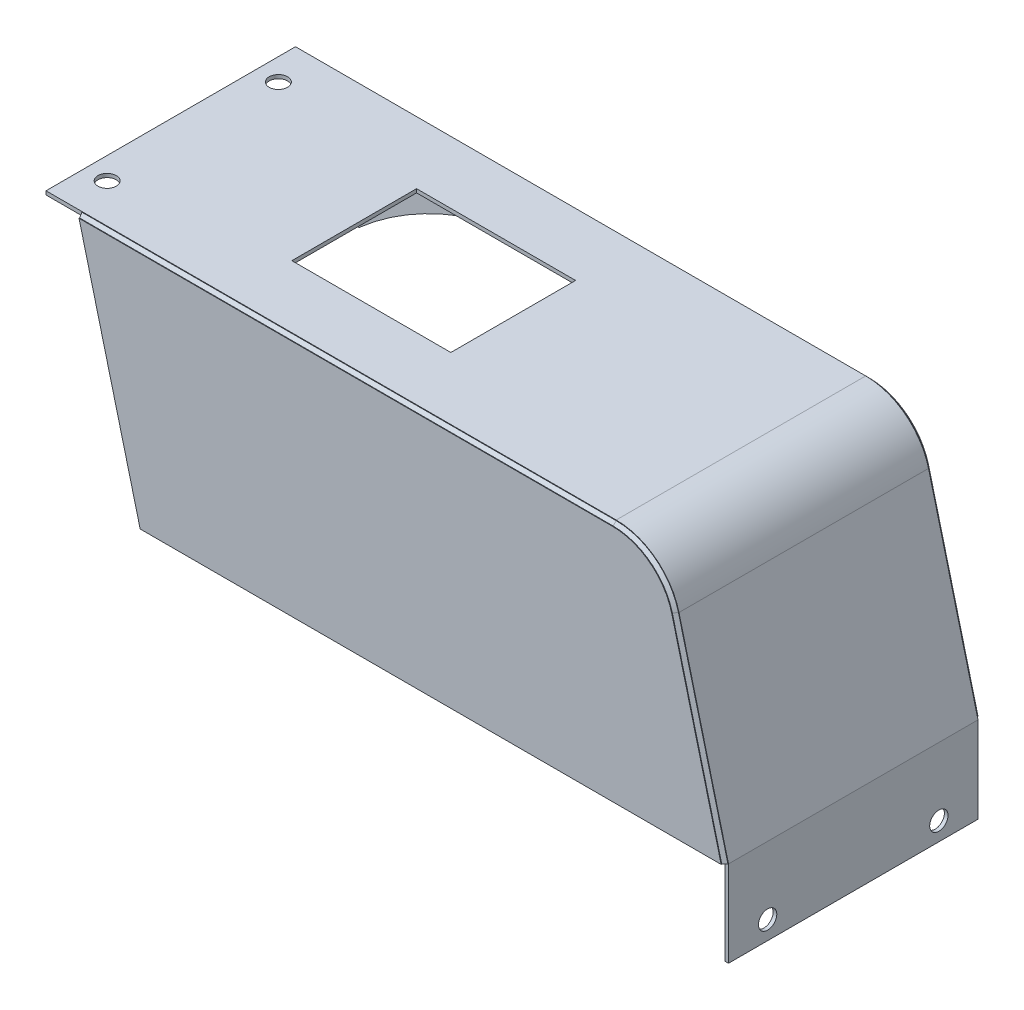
SolidWorks part; units mm, degrees
other "Objet de détail2"
other "Objet de détail3"
ref_plane "Face" through (0, 0, 0) normal (0, 0, 1) x (1, 0, 0)
ref_plane "Dessus" through (0, 0, 0) normal (0, 1, 0) x (1, 0, 0)
ref_plane "Droite" through (0, 0, 0) normal (1, 0, 0) x (0, 0, -1)
sketch "Esquisse1" plane through (0, 0, 0) normal (0, 0, 1) x (1, 0, 0)
  line L0 (-457.5928, 52.5378) -> (8.6102, 52.5378)
  line L1 (57.0434, 14.9566) -> (97.4072, -142.4622)
  line L2 (97.4072, -142.4622) -> (97.4072, -212.4622)
  line L3 (-457.5928, 55.5378) -> (8.6102, 55.5378)
  line L4 (59.9494, 15.7017) -> (100.4072, -142.0837)
  line L5 (100.4072, -142.0837) -> (100.4072, -212.4622)
  line L6 (97.4072, -212.4622) -> (100.4072, -212.4622)
  line L7 (-457.5928, 55.5378) -> (-457.5928, 52.5378)
  arc A0 (8.6102, 52.5378) -> (57.0434, 14.9566) centre (8.6102, 2.5378) cw
  arc A1 (8.6102, 55.5378) -> (59.9494, 15.7017) centre (8.6102, 2.5378) cw
  point P6 (47.4072, 52.5378)
  dimension "D5" = 50
  dimension "D1" = 555
  dimension "D2" = 195
  dimension "D3" = 70
  dimension "D4" = 50
  dimension "D6" = 3
extrude "Extrusion1" add sketch "Esquisse1" along normal blind 204
sketch "Esquisse3" plane through (0, 0, 204) normal (0, 0, 1) x (1, 0, 0)
  line L0 (57.0434, 14.9566) -> (97.4072, -142.4622) construction
  line L1 (-457.5928, 52.5378) -> (8.6102, 52.5378) construction
  line L2 (57.0434, 14.9566) -> (97.4072, -142.4622)
  line L3 (-427.5928, 52.5378) -> (8.6102, 52.5378)
  line L4 (97.4072, -142.4622) -> (-377.5928, -142.4622)
  line L5 (-427.5928, 52.5378) -> (-377.5928, -142.4622)
  arc A0 (57.0434, 14.9566) -> (8.6102, 52.5378) centre (8.6102, 2.5378) ccw construction
  arc A1 (57.0434, 14.9566) -> (8.6102, 52.5378) centre (8.6102, 2.5378) ccw
  dimension "D1" = 50
  dimension "D2" = 525
extrude "Extrusion2" add sketch "Esquisse3" along normal mid plane 6 separate body
sketch "Esquisse4" plane through (0, 0, 0) normal (0, 0, -1) x (-1, 0, 0)
  line L0 (-97.4072, -142.4622) -> (-57.0434, 14.9566) construction
  line L1 (-8.6102, 52.5378) -> (427.5928, 52.5378) construction
  line L2 (-97.4072, -142.4622) -> (-57.0434, 14.9566)
  line L3 (-8.6102, 52.5378) -> (427.5928, 52.5378)
  line L4 (427.5928, 52.5378) -> (377.5928, -142.4622)
  line L5 (427.5928, 52.5378) -> (377.5928, -142.4622) construction
  line L6 (-97.4072, -142.4622) -> (377.5928, -142.4622)
  arc A0 (-8.6102, 52.5378) -> (-57.0434, 14.9566) centre (-8.6102, 2.5378) ccw construction
  arc A1 (-8.6102, 52.5378) -> (-57.0434, 14.9566) centre (-8.6102, 2.5378) ccw
extrude "Extrusion3" add sketch "Esquisse4" along normal mid plane 6 separate body
other "Cordon de soudure d'angle2" parameters "D10"=6, "D11"=2.5, "D12"=0, "D13"=3, "D14"=0
other "Cordon de soudure d'angle3" parameters "D10"=6, "D11"=2.5, "D12"=0, "D13"=3, "D14"=0
sketch "Esquisse6" plane through (0, 55.5378, 0) normal (0, 1, 0) x (-1, 0, 0)
  line L0 (-8.6102, 204) -> (457.5928, 204) construction
  line L1 (457.5928, 204) -> (457.5928, 0) construction
  circle A0 centre (439.5928, 172) radius 7.5
  circle A1 centre (439.5928, 32) radius 7.5
  dimension "D1" = 15
  dimension "D3" = 18
  dimension "D4" = 15
  dimension "D5" = 140
  dimension "D2" = 32
extrude "Enlèv. mat.-Extru.1" cut sketch "Esquisse6" against normal blind 6
sketch "Esquisse7" plane through (100.4072, 0, 0) normal (1, 0, 0) x (0, 0, -1)
  line L8 (-204, -212.4622) -> (0, -212.4622) construction
  line L9 (-204, -212.4622) -> (-204, -142.0837) construction
  circle A0 centre (-172, -197.4622) radius 7.5
  circle A1 centre (-32, -197.4622) radius 7.5
  dimension "D5" = 15
  dimension "D6" = 15
  dimension "D7" = 32
  dimension "D1" = 15
  dimension "D2" = 140
extrude "Enlèv. mat.-Extru.2" cut sketch "Esquisse7" against normal blind 3
sketch "Esquisse9" plane through (0, 0, -3) normal (0, 0, -1) x (-1, 0, 0)
  line L0 (-97.4072, -142.4622) -> (377.5928, -142.4622) construction
  circle A0 centre (227.5928, -242.4622) radius 265
  dimension "D1" = 530
  dimension "D2" = 100
  dimension "D3" = 200
extrude "Enlèv. mat.-Extru.3" cut sketch "Esquisse9" against normal blind 10
sketch "Esquisse10" plane through (0, 55.5378, 0) normal (0, 1, 0) x (-1, 0, 0)
  line L0 (-8.6102, 0) -> (457.5928, 0) construction
  line L1 (177.5928, 51) -> (307.5928, 51)
  line L2 (177.5928, 51) -> (177.5928, 153)
  line L3 (177.5928, 153) -> (307.5928, 153)
  line L4 (307.5928, 51) -> (307.5928, 153)
  line L5 (457.5928, 204) -> (457.5928, 0) construction
  dimension "D1" = 102
  dimension "D2" = 130
  dimension "D3" = 51
  dimension "D4" = 150
extrude "Enlèv. mat.-Extru.4" cut sketch "Esquisse10" against normal blind 10
